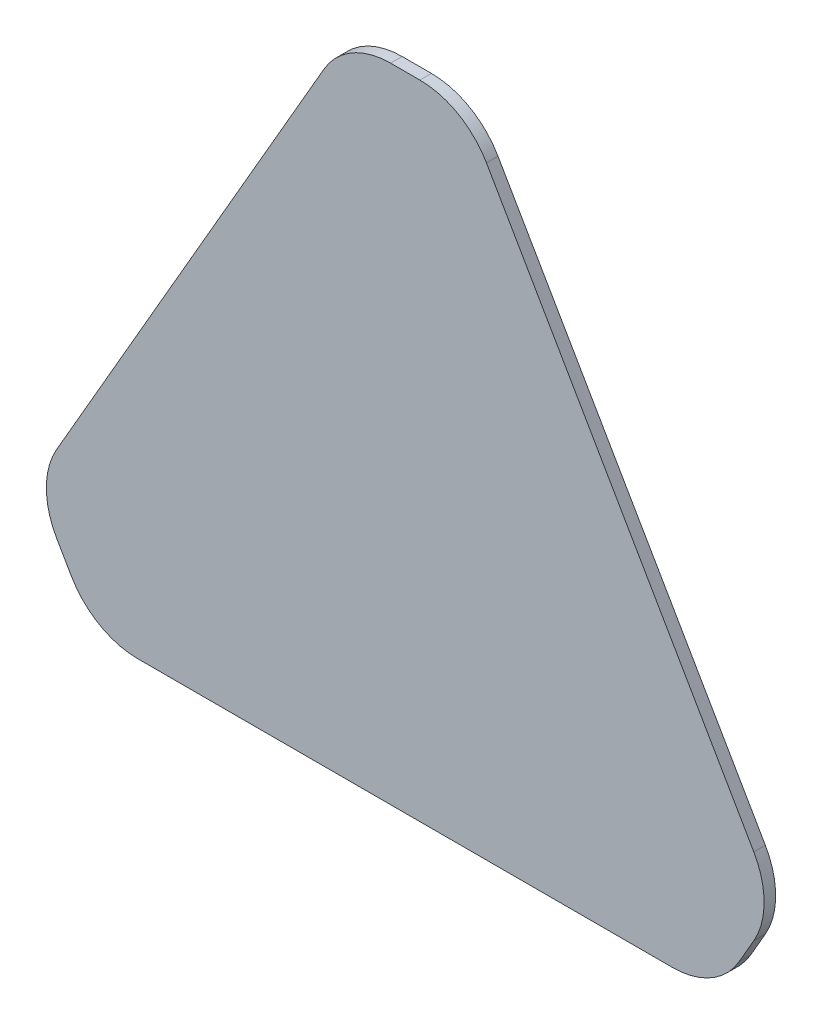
SolidWorks part; units mm, degrees
ref_plane "Front Plane" through (0, 0, 0) normal (0, 0, 1) x (1, 0, 0)
ref_plane "Top Plane" through (0, 0, 0) normal (0, 1, 0) x (1, 0, 0)
ref_plane "Right Plane" through (0, 0, 0) normal (1, 0, 0) x (0, 0, -1)
sketch "Sketch1" plane through (0, 0, 0) normal (0, 0, 1) x (1, 0, 0)
  line L6 (3.812, 102.5) -> (-3.812, 102.5)
  line L7 (-21.1325, 92.5) -> (-90.6736, -27.9487)
  line L8 (-90.6736, -47.9487) -> (-86.8616, -54.5513)
  line L9 (-69.5411, -64.5513) -> (69.5411, -64.5513)
  line L10 (86.8616, -54.5513) -> (90.6736, -47.9487)
  line L11 (90.6736, -27.9487) -> (21.1325, 92.5)
  line L12 (3.812, 102.5) -> (-3.812, 102.5)
  line L13 (-21.1325, 92.5) -> (-90.6736, -27.9487)
  line L14 (-90.6736, -47.9487) -> (-86.8616, -54.5513)
  line L15 (-69.5411, -64.5513) -> (69.5411, -64.5513)
  line L16 (86.8616, -54.5513) -> (90.6736, -47.9487)
  line L17 (90.6736, -27.9487) -> (21.1325, 92.5)
  arc A6 (-3.812, 102.5) -> (-21.1325, 92.5) centre (-3.812, 82.5) ccw
  arc A7 (-90.6736, -27.9487) -> (-90.6736, -47.9487) centre (-73.3531, -37.9487) ccw
  arc A8 (-86.8616, -54.5513) -> (-69.5411, -64.5513) centre (-69.5411, -44.5513) ccw
  arc A9 (69.5411, -64.5513) -> (86.8616, -54.5513) centre (69.5411, -44.5513) ccw
  arc A10 (90.6736, -47.9487) -> (90.6736, -27.9487) centre (73.3531, -37.9487) ccw
  arc A11 (21.1325, 92.5) -> (3.812, 102.5) centre (3.812, 82.5) ccw
  arc A12 (-3.812, 102.5) -> (-21.1325, 92.5) centre (-3.812, 82.5) ccw
  arc A13 (-90.6736, -27.9487) -> (-90.6736, -47.9487) centre (-73.3531, -37.9487) ccw
  arc A14 (-86.8616, -54.5513) -> (-69.5411, -64.5513) centre (-69.5411, -44.5513) ccw
  arc A15 (69.5411, -64.5513) -> (86.8616, -54.5513) centre (69.5411, -44.5513) ccw
  arc A16 (90.6736, -47.9487) -> (90.6736, -27.9487) centre (73.3531, -37.9487) ccw
  arc A17 (21.1325, 92.5) -> (3.812, 102.5) centre (3.812, 82.5) ccw
  dimension "D1" = 0
extrude "Boss-Extrude1" add sketch "Sketch1" along normal blind 3
